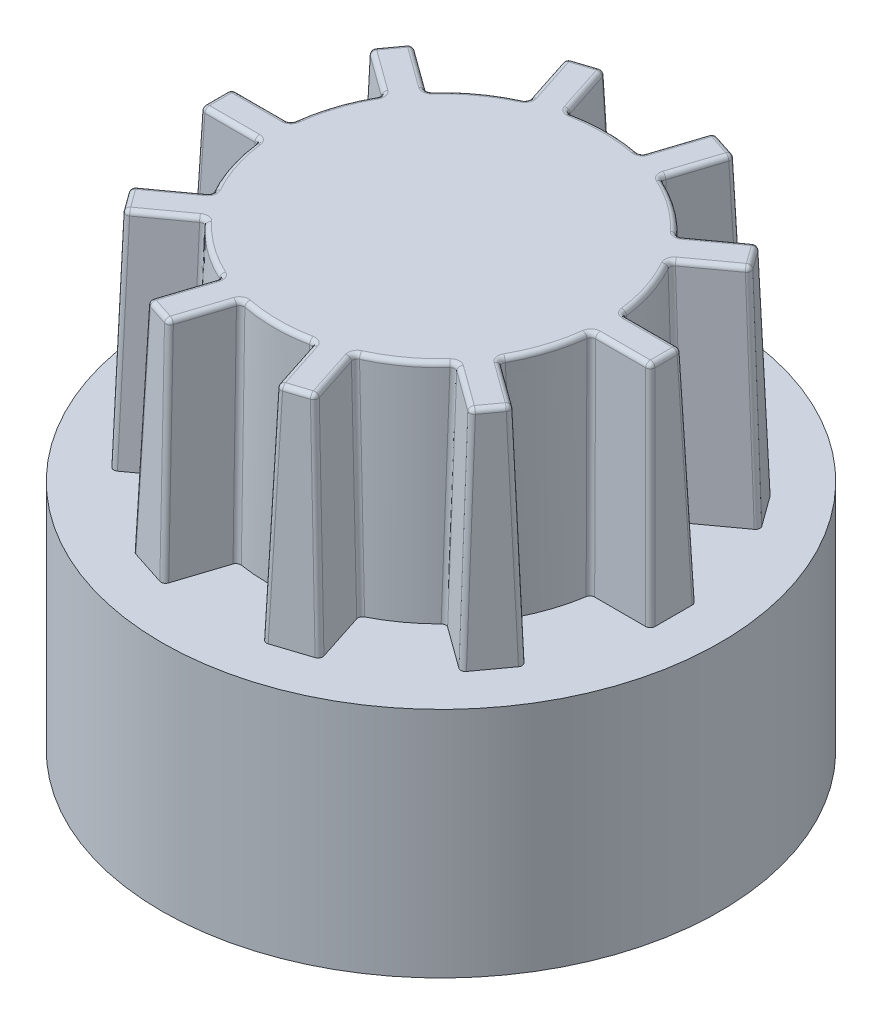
SolidWorks part; units mm, degrees
ref_plane "Front Plane" through (0, 0, 0) normal (0, 0, 1) x (1, 0, 0)
ref_plane "Top Plane" through (0, 0, 0) normal (0, 1, 0) x (1, 0, 0)
ref_plane "Right Plane" through (0, 0, 0) normal (1, 0, 0) x (0, 0, -1)
sketch "Sketch2" plane through (0, 0, 0) normal (0, 1, 0) x (1, 0, 0)
  line L1 (-100, 10) -> (100, 10)
  line L2 (-100, 10) -> (-100, -10)
  line L3 (-100, -10) -> (100, -10)
  line L4 (100, 10) -> (100, -10)
  line L5 (-100, 10) -> (100, -10) construction
  line L6 (-100, -10) -> (100, 10) construction
  circle A0 centre (0, 0) radius 75
  dimension "D1" = 150
  dimension "D2" = 20
  dimension "D3" = 200
extrude "Extrude1" add sketch "Sketch2" along normal blind 95 contours A0 L1 L2 L3 | A0 L3 L4 L1
draft "Draft1" type of draft neutral plane draft angle 2 faces to draft 8 parameters "D1"=2
pattern_circular "CirPattern1" count 5 over 360 about axis through (0, 0, 0) along (0, 1, 0) of "Extrude1", "Draft1"
fillet "Fillet1" radius 2 40 edges at (-84.4626, 47.5, -51.0553) (-74.6569, 47.5, -64.5518) (-38.3221, 47.5, -90.9505) (-22.4561, 47.5, -96.1057) (22.4561, 47.5, -96.1057) (38.3221, 47.5, -90.9505) (74.6569, 47.5, -64.5518) (84.4626, 47.5, -51.0553) (98.3413, 47.5, -8.3413) (98.3413, 47.5, 8.3413) (84.4626, 47.5, 51.0553) (74.6569, 47.5, 64.5518) (38.3221, 47.5, 90.9505) (22.4561, 47.5, 96.1057) (-22.4561, 47.5, 96.1057) (-38.3221, 47.5, 90.9505) (-74.6569, 47.5, 64.5518) (-84.4626, 47.5, 51.0553) (-98.3413, 47.5, 8.3413) (-98.3413, 47.5, -8.3413)
fillet "Fillet2" radius 2 80 edges at (-74.1604, 95, 61.4173) (-63.9696, 95, 54.7367) (-53.9985, 95, 48.0337) (-42.1339, 95, 57.9924) (-29.0787, 95, 66.0103) (-32.29, 95, 77.7533) (-35.4945, 95, 89.5098) (-29.8765, 95, 91.9505) (-23.8969, 95, 93.2781) (-19.5791, 95, 81.8833) (-15.4522, 95, 70.5996) (0, 95, 71.6825) (15.2747, 95, 70.4955) (19.5791, 95, 81.8833) (23.8969, 95, 93.2781) (29.8765, 95, 91.9505) (35.4945, 95, 89.5098) (32.29, 95, 77.7533) (28.9963, 95, 66.1988) (42.1339, 95, 57.9924) (53.7937, 95, 48.0538) (63.9696, 95, 54.7367) (74.1604, 95, 61.4173) (78.2178, 95, 56.8286) (81.3282, 95, 51.5518) (71.8254, 95, 43.9241) (62.3692, 95, 36.5124) (68.1741, 95, 22.1511) (71.7654, 95, 7.2572) (83.9259, 95, 6.6825) (96.0972, 95, 6.0972) (96.6825, 95, 0) (96.0972, 95, -6.0972) (83.9259, 95, -6.6825) (71.9192, 95, -7.1206) (68.1741, 95, -22.1511) (62.3251, 95, -36.3114) (71.8254, 95, -43.9241) (81.3282, 95, -51.5518) (78.2178, 95, -56.8286) (74.1604, 95, -61.4173) (63.9696, 95, -54.7367) (53.9985, 95, -48.0337) (42.1339, 95, -57.9924) (29.0787, 95, -66.0103) (32.29, 95, -77.7533) (35.4945, 95, -89.5098) (29.8765, 95, -91.9505) (23.8969, 95, -93.2781) (19.5791, 95, -81.8833) (15.4522, 95, -70.5996) (0, 95, -71.6825) (-15.2747, 95, -70.4955) (-19.5791, 95, -81.8833) (-23.8969, 95, -93.2781) (-29.8765, 95, -91.9505) (-35.4945, 95, -89.5098) (-32.29, 95, -77.7533) (-28.9963, 95, -66.1988) (-42.1339, 95, -57.9924) (-53.7937, 95, -48.0538) (-63.9696, 95, -54.7367) (-74.1604, 95, -61.4173) (-78.2178, 95, -56.8286) (-81.3282, 95, -51.5518) (-71.8254, 95, -43.9241) (-62.3692, 95, -36.5124) (-68.1741, 95, -22.1511) (-71.7654, 95, -7.2572) (-83.9259, 95, -6.6825) (-96.0972, 95, -6.0972) (-96.6825, 95, 0) (-96.0972, 95, 6.0972) (-83.9259, 95, 6.6825) (-71.9192, 95, 7.1206) (-68.1741, 95, 22.1511) (-62.3251, 95, 36.3114) (-71.8254, 95, 43.9241) (-81.3282, 95, 51.5518) (-78.2178, 95, 56.8286)
sketch "Sketch3" plane through (0, 0, 0) normal (0, -1, 0) x (1, 0, 0)
  circle A0 centre (0, 0) radius 120
  dimension "D1" = 240
extrude "Extrude2" add sketch "Sketch3" along normal blind 100
